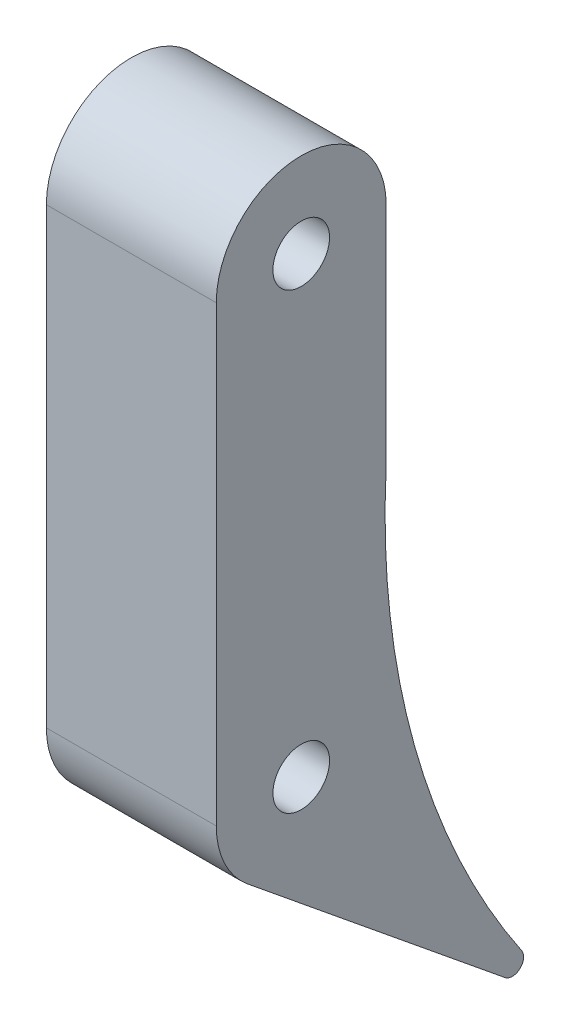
SolidWorks part; units mm, degrees
ref_plane "Front Plane" through (0, 0, 0) normal (0, 0, 1) x (1, 0, 0)
ref_plane "Top Plane" through (0, 0, 0) normal (0, 1, 0) x (1, 0, 0)
ref_plane "Right Plane" through (0, 0, 0) normal (1, 0, 0) x (0, 0, -1)
sketch "Sketch2" plane through (0, 0, 0) normal (1, 0, 0) x (0, 0, -1)
  line L0 (0, 0) -> (0, 40) construction
  line L1 (24.7173, -29.8212) -> (-4.7383, -5.8136)
  line L2 (24.7173, -29.8212) -> (7.5, 0) construction
  line L3 (7.5, 0) -> (7.5, 40) construction
  line L4 (-7.5, 0) -> (-7.5, 40) construction
  line L5 (-7.5, 0) -> (-7.5, 40)
  line L6 (-7.5, 40) -> (7.5, 40) construction
  line L9 (7.5, 40) -> (7.5, 20)
  circle A0 centre (0, 0) radius 7.5 construction
  circle A2 centre (0, 40) radius 7.5 construction
  circle A14 centre (0, 40) radius 2.5
  arc A15 (7.5, 40) -> (-7.5, 40) centre (0, 40) ccw
  arc A16 (-4.7383, -5.8136) -> (-7.5, 0) centre (0, 0) cw
  circle A17 centre (0, 0) radius 2.5
  arc A18 (24.7173, -29.8212) -> (7.5, 20) centre (77.4006, 16.2707) cw
  dimension "D2" = 15
  dimension "D7" = 20
  dimension "D4" = 5
  dimension "D5" = 70
  dimension "D1" = 150
  dimension "D3" = 40
  dimension "D6" = 38
extrude "Boss-Extrude1" add sketch "Sketch2" along normal mid plane 15
fillet "Fillet1" radius 1 1 edges at (0, -29.8212, -24.7173)
ref_plane "Plane2" through (-15, 0, 0) normal (-1, 0, 0) x (0, 0, 1)
fillet "Fillet2" radius 10 1 edges at (0, 20, -7.5)
